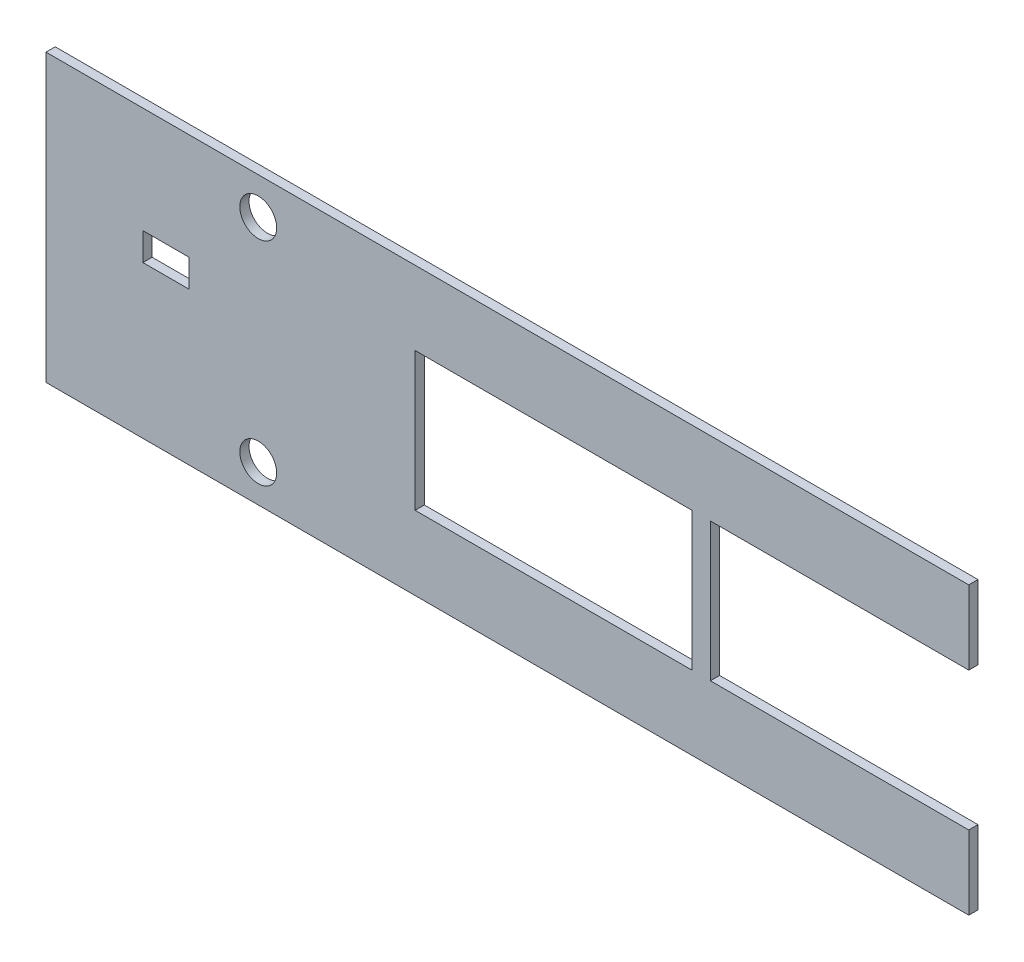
SolidWorks part; units mm, degrees
ref_plane "Plan XY" through (0, 0, 0) normal (0, 0, 1) x (1, 0, 0)
ref_plane "Plan XZ" through (0, 0, 0) normal (0, 1, 0) x (1, 0, 0)
ref_plane "Plan YZ" through (0, 0, 0) normal (1, 0, 0) x (0, 0, -1)
sketch "2 postes + pilotes" plane through (0, 0, 0) normal (0, 0, 1) x (1, 0, 0)
  line L0 (2.5, 10) -> (7.5, 10) construction
  line L1 (0, 0) -> (30, 0)
  line L2 (0, 0) -> (0, 15)
  line L3 (0, 15) -> (30, 15)
  line L4 (30, 0) -> (30, 15)
  line L5 (2.5, 11.5) -> (7.5, 11.5) construction
  line L6 (2.5, 11.5) -> (2.5, 8.5) construction
  line L7 (2.5, 8.5) -> (7.5, 8.5) construction
  line L8 (7.5, 11.5) -> (7.5, 8.5) construction
  line L9 (5, 11.5) -> (5, 8.5) construction
  line L10 (-27, 11.5) -> (-27, 8.5) construction
  line L11 (-29.5, 11.5) -> (-24.5, 11.5)
  line L12 (-29.5, 11.5) -> (-29.5, 8.5)
  line L13 (-29.5, 8.5) -> (-24.5, 8.5)
  line L14 (-24.5, 11.5) -> (-24.5, 8.5)
  line L15 (-32, 15) -> (-2, 15) construction
  line L16 (-32, 15) -> (-32, 0) construction
  line L17 (-32, 0) -> (-2, 0) construction
  line L18 (-2, 15) -> (-2, 0) construction
  line L19 (-29.5, 10) -> (-24.5, 10) construction
  line L20 (-32, 7.5) -> (-42.1578, 7.5) construction
  line L21 (-17, 15) -> (-17, 0) construction
  line L22 (-40, 23) -> (60, 23)
  line L23 (-40, -8) -> (60, -8)
  line L24 (-40, -8) -> (-40, 23)
  line L25 (32, 15) -> (60, 15)
  line L26 (32, 0) -> (32, 15)
  line L27 (32, 0) -> (60, 0)
  line L29 (60, 23) -> (60, 15)
  line L30 (60, 0) -> (60, -8)
  line L31 (62, 0) -> (62, 15)
  circle A0 centre (-17, 19) radius 2
  circle A1 centre (-17, -4) radius 2
  dimension "D12" = 4
  dimension "D1" = 30
  dimension "D2" = 15
  dimension "D3" = 5
  dimension "D4" = 3
  dimension "D5" = 10
  dimension "D6" = 5
  dimension "D7" = 5
  dimension "D8" = 2
  dimension "D9" = 5
  dimension "D10" = 30
  dimension "D11" = 32
  dimension "D13" = 4
  dimension "D14" = 4
  dimension "D15" = 40
  dimension "D16" = 2
  dimension "D17" = 2
  dimension "D18" = 60
extrude "Boss.-Extru.1" add sketch "2 postes + pilotes" along normal blind 1
equation "\"D10@2 postes + pilotes\"= \"D1@2 postes + pilotes\""
equation "\"D7@2 postes + pilotes\"= \"D3@2 postes + pilotes\""
equation "\"D9@2 postes + pilotes\"= \"D6@2 postes + pilotes\""
equation "\"D17@2 postes + pilotes\"= \"D8@2 postes + pilotes\""
